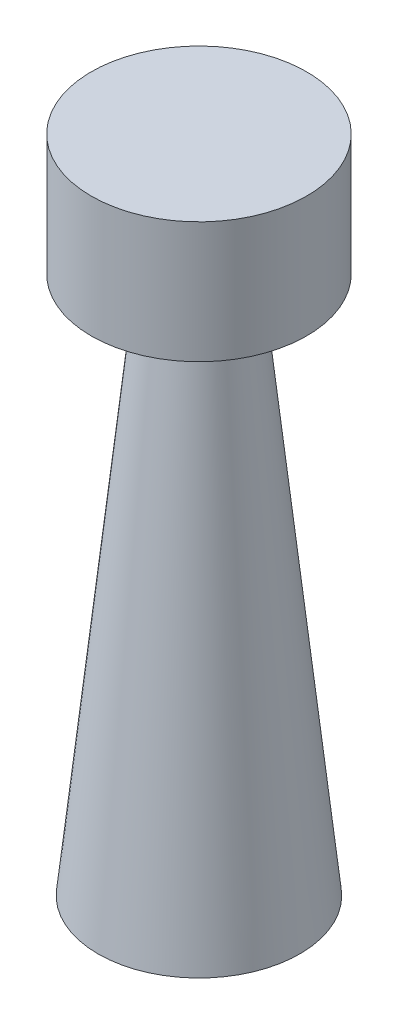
SolidWorks part; units mm, degrees
ref_plane "Plan de face" through (0, 0, 0) normal (0, 0, 1) x (1, 0, 0)
ref_plane "Plan de dessus" through (0, 0, 0) normal (0, 1, 0) x (1, 0, 0)
ref_plane "Plan de droite" through (0, 0, 0) normal (1, 0, 0) x (0, 0, -1)
sketch "Esquisse1" plane through (0, 0, 0) normal (0, 1, 0) x (1, 0, 0)
  circle A0 centre (0, 0) radius 375
  dimension "D1" = 750
extrude "Boss.-Extru.1" add sketch "Esquisse1" along normal blind 2000 draft 6 contours A0
sketch "Esquisse2" plane through (0, 2000, 0) normal (0, 1, 0) x (1, 0, 0)
  circle A0 centre (0, 0) radius 400
  dimension "D1" = 800
extrude "Boss.-Extru.2" add sketch "Esquisse2" along normal blind 450
